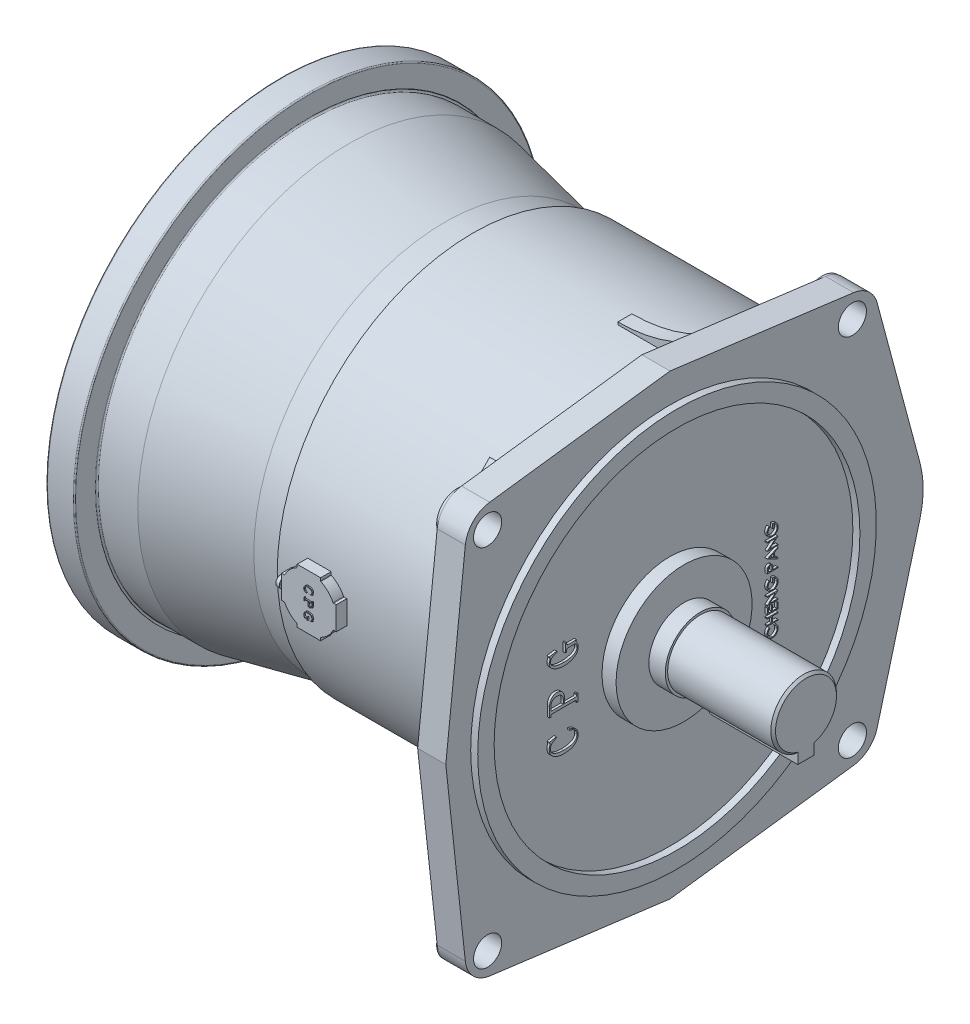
SolidWorks part; units mm, degrees
ref_plane "前视基准面" through (0, 0, 0) normal (0, 0, 1) x (1, 0, 0)
ref_plane "上视基准面" through (0, 0, 0) normal (0, 1, 0) x (1, 0, 0)
ref_plane "右视基准面" through (0, 0, 0) normal (1, 0, 0) x (0, 0, -1)
sketch "草图1" plane through (0, 0, 0) normal (0, 1, 0) x (1, 0, 0)
  line L0 (0, 0) -> (15.7361, 0) construction
  line L1 (0, 0) -> (0, -14)
  line L2 (0, -14) -> (-45, -14)
  line L3 (-45, -14) -> (-45, -15)
  line L4 (-45, -15) -> (-52, -15)
  line L5 (-55, -29) -> (-55, -85)
  line L6 (-55, -85) -> (-58, -85)
  line L7 (-58, -85) -> (-58, 0)
  line L8 (-58, 0) -> (0, 0)
  line L9 (-55, -29) -> (-52, -29)
  line L10 (-52, -29) -> (-52, -15)
  dimension "D1" = 45
  dimension "D2" = 28
  dimension "D3" = 30
  dimension "D4" = 3
  dimension "D5" = 170
  dimension "D6" = 58
  dimension "D7" = 3
  dimension "D8" = 58
revolve "旋转1" add sketch "草图1" angle 360 about L0
sketch "草图2" plane through (0, 0, 0) normal (0, 1, 0) x (1, 0, 0)
  line L0 (8.0167, 23) -> (-70, 23) construction
  line L1 (-58, 85) -> (-58, -85) construction
  line L4 (-70, 23) -> (-70, -60.5)
  line L5 (-70, -60.5) -> (-165, -60.5)
  line L6 (-165, -60.5) -> (-165, 23)
  line L11 (-70, 23) -> (-165, 23)
  dimension "D1" = 23
  dimension "D2" = 12
  dimension "D3" = 167
  dimension "D5" = 95
revolve "旋转2" add sketch "草图2" angle 360 about L0
sketch "草图12" plane through (-70, 0, 0) normal (1, 0, 0) x (0, 0, -1)
  line L0 (0, -97.5) -> (86.267, -86.267)
  line L1 (-86.267, -86.267) -> (0, -97.5)
  line L2 (-86.267, -86.267) -> (-95.6178, 0)
  line L3 (-86.267, 86.267) -> (0, 97.5)
  line L4 (86.267, -86.267) -> (109.3822, 0)
  line L5 (-95.6178, 0) -> (-86.267, 86.267)
  line L6 (0, 97.5) -> (86.267, 86.267)
  line L7 (109.3822, 0) -> (86.267, 86.267)
  line L8 (167.8979, 0) -> (-107.2143, 0) construction
  line L9 (0, 107.5085) -> (0, -103.3164) construction
  line L10 (0, 0) -> (-77.7817, 77.7817) construction
  line L11 (0, 0) -> (77.7817, 77.7817) construction
  circle A0 centre (0, 0) radius 110 construction
  circle A1 centre (-77.7817, 77.7817) radius 6
  circle A2 centre (77.7817, 77.7817) radius 6
  circle A3 centre (77.7817, -77.7817) radius 6
  circle A4 centre (-77.7817, -77.7817) radius 6
  dimension "D3" = 220
  dimension "D4" = 12
  dimension "D5" = 15
  dimension "D1" = 195
  dimension "D2" = 205
  dimension "D6" = 12
extrude "拉伸8" add sketch "草图12" along normal up to surface (12 mm away)
sketch "草图5" plane through (0, 0, 0) normal (0, 1, 0) x (1, 0, 0)
  line L0 (0, -3.5) -> (-36.5, -3.5)
  line L1 (0, -14) -> (0, 14) construction
  line L2 (-36.5, 3.5) -> (0, 3.5)
  line L3 (0, 3.5) -> (0, -3.5)
  line L4 (31.1, -13.7955) -> (31.1, 19.6443) construction
  arc A0 (-36.5, -3.5) -> (-36.5, 3.5) centre (-36.5, 0) cw
  dimension "D2" = 40
  dimension "D1" = 7
  dimension "D3" = 31.1
extrude "拉伸4" add sketch "草图5" against normal blind 17.1
fillet "圆角4" radius 12 4 edges at (-64, 86.267, 86.267) (-64, 86.267, -86.267) (-64, -86.267, -86.267) (-64, -86.267, 86.267)
fillet "圆角5" radius 40 1 edges at (-64, 0, -109.3822)
chamfer "倒角1" distance 1 angle 45 1 edges at (0, 14, 0)
sketch "草图18" plane through (-70, 0, 0) normal (-1, 0, 0) x (0, 0, 1)
  line L0 (-23, 0) -> (65.9169, -88.9169) construction
  line L1 (0, -90.75) -> (0, 90.75) construction
  line L2 (76.9039, -87.4862) -> (0, -97.5) construction
  line L3 (36.0434, -59.0434) -> (65.9169, -88.9169)
  line L4 (-23, 0) -> (-77.7817, -77.7817) construction
  line L5 (-76.7543, -75.4044) -> (-71.081, -68.2676)
  line L7 (-23, 0) -> (-23, -94.5051) construction
  line L8 (0, -97.5) -> (-78.3038, -87.3039) construction
  line L9 (-23, -85.3881) -> (-23, -94.5051)
  circle A0 centre (-23, 0) radius 83.5 construction
  arc A1 (-88.3455, -78.5102) -> (-78.3038, -87.3039) centre (-76.7543, -75.4044) ccw construction
  dimension "D1" = 45
  dimension "D2" = 9.117
  dimension "D4" = 42.2474
  dimension "D5" = 9.117
ref_plane "基准面7" through (-71, 0, 0) normal (1, 0, 0) x (0, 0, -1)
sketch "草图13" plane through (-70, 0, 0) normal (1, 0, 0) x (0, 0, -1)
  line L5 (0, 0) -> (107.7406, 0) construction
  circle A1 centre (77.7817, 77.7817) radius 9.4101
  circle A3 centre (77.7817, 77.7817) radius 6
  circle A4 centre (77.7817, -77.7817) radius 6 construction
  circle A5 centre (77.7817, -77.7817) radius 6
  circle A7 centre (-77.7817, -77.7817) radius 6
  arc A10 (78.3038, -87.3039) -> (88.3455, -78.5102) centre (76.7543, -75.4044) ccw construction
  circle A11 centre (-77.7817, -77.7817) radius 6 construction
  arc A12 (-87.2845, -76.8798) -> (-76.9039, -87.4862) centre (-75.3544, -75.5867) ccw construction
  circle A14 centre (-77.7817, 77.7817) radius 6
  circle A15 centre (-77.7817, 77.7817) radius 8.7273
  circle A20 centre (-77.7817, -77.7817) radius 8.7273
  circle A21 centre (77.7817, -77.7817) radius 9.4101
  point P8 (23, 0)
extrude "拉伸9" add sketch "草图13" against normal up to surface (1 mm away)
sketch "草图14" plane through (0, 0, 0) normal (0, 1, 0) x (1, 0, 0)
  line L0 (-70, 23) -> (-165, 23) construction
  line L5 (-70, -76.9039) -> (-70, 0) construction
  line L6 (-100.2474, -60.5) -> (-100.2474, -61.5)
  line L7 (-70, -90.7474) -> (-71, -90.7474)
  line L9 (-70, -60.5) -> (-165, -60.5) construction
  arc A0 (-71, -90.7474) -> (-100.2474, -61.5) centre (-100.2474, -90.7474) ccw
  dimension "D1" = 113.7474
  dimension "D2" = 1
  dimension "D3" = 1
rib "筋17" sketch "草图14" sketch "草图14" thickness 6 extrusion direction parallel to sketch draft on no parameters "D1"=6
pattern_circular "阵列(圆周)16" count 8 over 360 about axis through (0, 0, -23) along (1, 0, 0) of "筋17"
ref_plane "基准面8" through (0, 0, -23) normal (0, 0, 1) x (1, 0, 0)
sketch "草图17" plane through (0, 0, -23) normal (0, 0, 1) x (1, 0, 0)
  line L0 (-70, -91.617) -> (-71, -91.617)
  line L1 (-70, -87.4862) -> (-70, -97.5) construction
  line L2 (-100.2474, -83.5) -> (-100.2474, -84.5)
  line L4 (-165, -83.5) -> (-70, -83.5) construction
  line L6 (-100.2474, -61.8718) -> (-100.2474, -57.6292) construction
  arc A0 (-71, -91.617) -> (-100.2474, -84.5) centre (-100.2474, -148.1546) ccw
  dimension "D1" = 8.117
  dimension "D2" = 1
  dimension "D3" = 1
rib "筋24" sketch "草图17" sketch "草图17" thickness 6 extrusion direction parallel to sketch draft on no parameters "D1"=6
mirror "镜向1" about plane through (0, 0, 0) normal (0, 1, 0) of "筋24"
sketch "草圖1" plane through (0, 0, 0) normal (0, 1, 0) x (1, 0, 0)
  line L0 (-233.4998, 23) -> (-165, 23)
  line L1 (-246.4998, 123) -> (-235.4998, 123)
  line L2 (-234.9998, 122.5) -> (-234.9998, 114.0026)
  line L3 (-234.7902, 113) -> (-217.9998, 113)
  line L4 (-217.9998, 113) -> (-177, 104.5)
  line L5 (-205.9998, 70.375) -> (-205.9998, 71.1207)
  line L6 (-246.9998, 122.5) -> (-246.9998, 88)
  line L7 (-232.9998, 64) -> (-207.9998, 64)
  line L8 (-234.9998, 62) -> (-234.9998, 49)
  line L9 (-272.0981, 23) -> (-165, 23) construction
  line L10 (-246.9998, 88) -> (-242.6998, 88)
  line L11 (-207.3496, 76.0029) -> (-242.6998, 88)
  line L12 (-233.4998, 49) -> (-233.4998, 23)
  line L13 (-204.6838, 73.0001) -> (-204.6838, 73.0215)
  line L14 (-234.9998, 49) -> (-233.4998, 49)
  line L15 (-165, 104.5) -> (-165, 23)
  line L16 (-177, 104.5) -> (-165, 104.5)
  arc A0 (-204.6838, 73.0001) -> (-205.9998, 71.1207) centre (-203.9998, 71.1207) ccw
  arc A1 (-207.9998, 64) -> (-205.9998, 70.375) centre (-215.8093, 69.9513) ccw
  arc A2 (-232.9998, 64) -> (-234.9998, 62) centre (-232.9998, 62) ccw
  arc A6 (-204.6838, 73.0215) -> (-207.3496, 76.0029) centre (-207.6838, 73.0215) ccw
  arc A7 (-234.9998, 114.0026) -> (-234.7902, 113) centre (-234.7902, 113.5232) ccw
  arc A8 (-246.4998, 123) -> (-246.9998, 122.5) centre (-246.4998, 122.5) ccw
  arc A9 (-234.9998, 122.5) -> (-235.4998, 123) centre (-235.4998, 122.5) ccw
  dimension "D1" = 200
  dimension "D2" = 130
  dimension "D3" = 246.9998
  dimension "D4" = 165
  dimension "D6" = 81.9998
  dimension "D12" = 180
  dimension "D13" = 163
  dimension "D14" = 23
revolve "旋轉1" add sketch "草圖1" angle 360 about L9
sketch "草圖2" plane through (-246.9998, 0, 0) normal (-1, 0, 0) x (0, 0, 1)
  line L0 (-23, 0) -> (-23, 120.5316) construction
  circle A0 centre (-23, 0) radius 82.5 construction
  circle A1 centre (-81.3363, 58.3363) radius 5
  circle A2 centre (35.3363, 58.3363) radius 5
  circle A3 centre (35.3363, -58.3363) radius 5
  circle A4 centre (-81.3363, -58.3363) radius 5
  dimension "D1" = 165
  dimension "D2" = 10
extrude "伸長1" cut sketch "草圖2" against normal blind 25
sketch "草圖3" plane through (-246.9998, 0, 0) normal (-1, 0, 0) x (0, 0, 1)
  line L30 (29.4023, 23.0903) -> (47.6304, 31.1223)
  line L31 (26.5204, 27.4054) -> (35.2893, 34.6515)
  line L32 (-75.4023, -23.0903) -> (-93.6304, -31.1223)
  line L33 (-50.4054, 49.5204) -> (-57.6515, 58.2893)
  line L34 (36.1698, 46.1366) -> (30.033, 53.033)
  line L35 (29.4023, -23.0903) -> (47.6304, -31.1223)
  line L36 (4.4054, -49.5204) -> (11.6515, -58.2893)
  line L37 (26.5204, -27.4054) -> (35.2893, -34.6515)
  line L38 (-69.1366, 59.1698) -> (-76.033, 53.033)
  line L39 (-72.5204, 27.4054) -> (-81.2893, 34.6515)
  line L40 (23.1366, -59.1698) -> (30.033, -53.033)
  line L41 (0.0903, -52.4023) -> (8.1223, -70.6304)
  line L42 (36.1698, -46.1366) -> (30.033, -53.033)
  line L43 (-46.0903, -52.4023) -> (-54.1223, -70.6304)
  line L44 (0.0903, 52.4023) -> (8.1223, 70.6304)
  line L45 (-82.1698, -46.1366) -> (-76.033, -53.033)
  line L46 (-72.5204, -27.4054) -> (-81.2893, -34.6515)
  line L47 (-50.4054, -49.5204) -> (-57.6515, -58.2893)
  line L48 (-69.1366, -59.1698) -> (-76.033, -53.033)
  line L49 (-23, 0) -> (-23, 84.5) construction
  line L50 (-23, 0) -> (-23, -84.5) construction
  line L51 (-46.0903, 52.4023) -> (-54.1223, 70.6304)
  line L52 (23.1366, 59.1698) -> (30.033, 53.033)
  line L53 (-75.4023, 23.0903) -> (-93.6304, 31.1223)
  line L54 (4.4054, 49.5204) -> (11.6515, 58.2893)
  line L55 (-82.1698, 46.1366) -> (-76.033, 53.033)
  line L56 (-23, 0) -> (-107.5, 0) construction
  line L57 (-23, 0) -> (61.5, 0) construction
  arc A48 (-82.1698, 46.1366) -> (-81.2893, 34.6515) centre (-76.1934, 40.8184) ccw
  arc A50 (57.0874, 26.949) -> (61.5, 0) centre (-23, 0) cw
  arc A51 (57.0874, -26.949) -> (61.5, 0) centre (-23, 0) ccw
  arc A52 (0.0903, -52.4023) -> (0.9103, -49.5308) centre (1.7798, -51.3319) cw
  arc A53 (3.949, -80.0874) -> (8.1223, -70.6304) centre (1.7166, -73.453) ccw
  arc A54 (-46.0903, -52.4023) -> (-46.9103, -49.5308) centre (-47.7798, -51.3319) ccw
  arc A55 (-103.0874, -26.949) -> (-107.5, 0) centre (-23, 0) cw
  arc A56 (0.0903, 52.4023) -> (0.9103, 49.5308) centre (1.7798, 51.3319) ccw
  arc A57 (26.0121, 24.9562) -> (26.5308, 23.9103) centre (-23, 0) cw
  arc A58 (26.0121, -24.9562) -> (26.5308, -23.9103) centre (-23, 0) ccw
  arc A59 (-103.0874, -26.949) -> (-93.6304, -31.1223) centre (-96.453, -24.7166) ccw
  arc A60 (23.1366, 59.1698) -> (11.6515, 58.2893) centre (17.8184, 53.1934) ccw
  arc A61 (26.0121, 24.9562) -> (26.5204, 27.4054) centre (27.7944, 25.8637) cw
  arc A62 (1.9562, -49.0121) -> (0.9103, -49.5308) centre (-23, 0) cw
  arc A63 (-75.4023, -23.0903) -> (-72.5308, -23.9103) centre (-74.3319, -24.7798) cw
  arc A64 (-103.0874, 26.949) -> (-107.5, 0) centre (-23, 0) ccw
  arc A65 (-103.0874, 26.949) -> (-93.6304, 31.1223) centre (-96.453, 24.7166) cw
  arc A66 (-82.1698, -46.1366) -> (-81.2893, -34.6515) centre (-76.1934, -40.8184) cw
  arc A67 (3.949, 80.0874) -> (-23, 84.5) centre (-23, 0) ccw
  arc A68 (1.9562, 49.0121) -> (4.4054, 49.5204) centre (2.8637, 50.7944) ccw
  arc A69 (36.1698, -46.1366) -> (35.2893, -34.6515) centre (30.1934, -40.8184) ccw
  arc A70 (23.1366, -59.1698) -> (11.6515, -58.2893) centre (17.8184, -53.1934) cw
  arc A71 (-47.9562, 49.0121) -> (-50.4054, 49.5204) centre (-48.8637, 50.7944) cw
  arc A72 (-46.0903, 52.4023) -> (-46.9103, 49.5308) centre (-47.7798, 51.3319) cw
  arc A73 (29.4023, -23.0903) -> (26.5308, -23.9103) centre (28.3319, -24.7798) ccw
  arc A74 (1.9562, -49.0121) -> (4.4054, -49.5204) centre (2.8637, -50.7944) cw
  arc A75 (-72.0121, -24.9562) -> (-72.5204, -27.4054) centre (-73.7944, -25.8637) cw
  arc A76 (-47.9562, 49.0121) -> (-46.9103, 49.5308) centre (-23, 0) cw
  arc A77 (57.0874, -26.949) -> (47.6304, -31.1223) centre (50.453, -24.7166) cw
  circle A78 centre (-23, 0) radius 50
  arc A79 (-69.1366, -59.1698) -> (-57.6515, -58.2893) centre (-63.8184, -53.1934) ccw
  arc A80 (-75.4023, 23.0903) -> (-72.5308, 23.9103) centre (-74.3319, 24.7798) ccw
  arc A81 (-49.949, -80.0874) -> (-23, -84.5) centre (-23, 0) ccw
  arc A82 (-72.0121, -24.9562) -> (-72.5308, -23.9103) centre (-23, 0) cw
  arc A83 (-72.0121, 24.9562) -> (-72.5308, 23.9103) centre (-23, 0) ccw
  arc A84 (57.0874, 26.949) -> (47.6304, 31.1223) centre (50.453, 24.7166) ccw
  arc A85 (-47.9562, -49.0121) -> (-46.9103, -49.5308) centre (-23, 0) ccw
  arc A86 (-49.949, 80.0874) -> (-54.1223, 70.6304) centre (-47.7166, 73.453) ccw
  arc A87 (-72.0121, 24.9562) -> (-72.5204, 27.4054) centre (-73.7944, 25.8637) ccw
  arc A88 (3.949, -80.0874) -> (-23, -84.5) centre (-23, 0) cw
  arc A89 (-49.949, -80.0874) -> (-54.1223, -70.6304) centre (-47.7166, -73.453) cw
  arc A90 (-47.9562, -49.0121) -> (-50.4054, -49.5204) centre (-48.8637, -50.7944) ccw
  arc A91 (-49.949, 80.0874) -> (-23, 84.5) centre (-23, 0) cw
  arc A92 (-69.1366, 59.1698) -> (-57.6515, 58.2893) centre (-63.8184, 53.1934) cw
  arc A93 (3.949, 80.0874) -> (8.1223, 70.6304) centre (1.7166, 73.453) cw
  arc A94 (29.4023, 23.0903) -> (26.5308, 23.9103) centre (28.3319, 24.7798) cw
  arc A95 (1.9562, 49.0121) -> (0.9103, 49.5308) centre (-23, 0) ccw
  arc A96 (36.1698, 46.1366) -> (35.2893, 34.6515) centre (30.1934, 40.8184) cw
  arc A97 (26.0121, -24.9562) -> (26.5204, -27.4054) centre (27.7944, -25.8637) ccw
  point P144 (-62.9374, 64.6861)
  point P173 (41.6861, 39.9374)
  point P201 (16.9374, -64.6861)
  point P228 (-87.6861, -39.9374)
  dimension "D5" = 110
  dimension "D6" = 100
extrude "伸長2" cut sketch "草圖3" against normal blind 50
sketch "草圖4" plane through (-196.9998, 0, 0) normal (-1, 0, 0) x (0, 0, 1)
  circle A0 centre (-23, 0) radius 66.5 construction
  circle A1 centre (-70.0226, 47.0226) radius 3.5
  circle A2 centre (24.0226, 47.0226) radius 3.5
  circle A3 centre (24.0226, -47.0226) radius 3.5
  circle A4 centre (-70.0226, -47.0226) radius 3.5
  dimension "D1" = 133
  dimension "D2" = 7
extrude "伸長3" cut sketch "草圖4" against normal blind 11
sketch "草圖6" plane through (-233.4998, 0, 0) normal (-1, 0, 0) x (0, 0, 1)
  line L0 (-46.2551, 0) -> (0.2551, 0) construction
  line L1 (-23, 23.2551) -> (-23, -23.2551) construction
  line L2 (-10.7, 3) -> (-10.7, -3)
  line L3 (-13.4606, 3) -> (-14.1683, 3.5)
  line L4 (-10.7, 3) -> (-13.4606, 3)
  line L5 (-13.4606, -3) -> (-14.1683, -3.5)
  line L6 (-10.7, -3) -> (-13.4606, -3)
  arc A0 (-14.1683, 3.5) -> (-14.1683, -3.5) centre (-23, 0) ccw
  circle A1 centre (-23, 0) radius 19.9 construction
  dimension "D1" = 9.5
extrude "伸長4" cut sketch "草圖6" against normal blind 40
sketch "草圖7" plane through (-233.4998, 0, 0) normal (-1, 0, 0) x (0, 0, 1)
  circle A0 centre (-23, 0) radius 19.9 construction
  circle A1 centre (-23, 0) radius 19.9
  arc A2 (-14.1683, 3.5) -> (-14.1683, -3.5) centre (-23, 0) ccw construction
  arc A3 (-14.1683, 3.5) -> (-14.1683, -3.5) centre (-23, 0) ccw
extrude "伸長5" add sketch "草圖7" along normal blind 1 contours A1 M6 M1 M2 M3 M4 M5
sketch "草圖8" plane through (-55, 0, 0) normal (1, 0, 0) x (0, 0, -1)
  circle A0 centre (0, 0) radius 78
  circle A1 centre (0, 0) radius 29 construction
  circle A2 centre (0, 0) radius 29
  dimension "D1" = 156
extrude "伸長6" cut sketch "草圖8" against normal blind 3
sketch "草圖9"
  dimension "D1" = 40
  dimension "D2" = 45
  dimension "D3" = 70
  dimension "D4" = 70
  dimension "D5" = 35
extrude "伸長7" add sketch "草圖9" along normal blind 1
ref_plane "平面1" through (0, 0, 65) normal (0, 0, 1) x (1, 0, 0)
sketch "草圖10" plane through (0, 0, 65) normal (0, 0, 1) x (1, 0, 0)
  line L0 (-152, 11.65) -> (-142, 11.65)
  line L1 (-152, 11.65) -> (-152, 10.5119)
  line L2 (-142, 11.65) -> (-142, 10.5119)
  line L3 (-152, -10.5119) -> (-152, -11.65)
  line L4 (-142, -10.5119) -> (-142, -11.65)
  line L5 (-158.65, 5) -> (-157.5119, 5)
  line L6 (-158.65, -5) -> (-157.5119, -5)
  line L7 (-158.65, -5) -> (-158.65, 5)
  line L8 (-152, -11.65) -> (-152, -10.5119)
  line L9 (-142, -11.65) -> (-142, -10.5119)
  line L10 (-142, -11.65) -> (-152, -11.65)
  line L11 (-135.35, -5) -> (-136.4881, -5)
  line L12 (-135.35, 5) -> (-136.4881, 5)
  line L13 (-135.35, 5) -> (-135.35, -5)
  arc A0 (-152.1383, 10.2882) -> (-157.2882, 5.1383) centre (-147, 0) ccw
  arc A1 (-152.1383, 10.2882) -> (-152, 10.5119) centre (-152.25, 10.5119) ccw
  arc A2 (-142, 10.5119) -> (-141.8617, 10.2882) centre (-141.75, 10.5119) ccw
  arc A3 (-157.5119, 5) -> (-157.2882, 5.1383) centre (-157.5119, 5.25) ccw
  arc A4 (-157.2882, -5.1383) -> (-157.5119, -5) centre (-157.5119, -5.25) ccw
  arc A5 (-152, -10.5119) -> (-152.1383, -10.2882) centre (-152.25, -10.5119) ccw
  arc A6 (-141.8617, -10.2882) -> (-142, -10.5119) centre (-141.75, -10.5119) ccw
  arc A7 (-136.4881, -5) -> (-136.7118, -5.1383) centre (-136.4881, -5.25) ccw
  arc A8 (-136.7118, 5.1383) -> (-136.4881, 5) centre (-136.4881, 5.25) ccw
  arc A9 (-136.7118, 5.1383) -> (-141.8617, 10.2882) centre (-147, 0) ccw
  arc A10 (-157.2882, -5.1383) -> (-152.1383, -10.2882) centre (-147, 0) ccw
  arc A11 (-141.8617, -10.2882) -> (-136.7118, -5.1383) centre (-147, 0) ccw
extrude "伸長8" add sketch "草圖10" against normal blind 4.5 contours A6 A11 A7 L11 L13 L12 A8 A9 A2 L2 L0 L1 A1 A0 A3 L5 L7 L6 A4 A10 A5 L3 L10 L4
sketch "草圖11"
extrude "伸長9" add sketch "草圖11" along normal blind 0.5
sketch "草圖12" plane through (0, 0, 0) normal (0, 1, 0) x (1, 0, 0)
  line L0 (-161.15, -62.75) -> (-153.15, -62.75)
  line L1 (-161.15, -62.75) -> (-161.15, -60.55)
  line L2 (-159.65, -61.3) -> (-159.65, -60.55)
  line L3 (-110, -65) -> (110, -65) construction
  line L13 (-157.65, -61.3) -> (-153.15, -61.55)
  line L15 (-159.65, -61.3) -> (-157.65, -61.3)
  line L23 (-161.15, -60.55) -> (-159.65, -60.55)
  line L24 (-157.65, -62.75) -> (-157.65, -61.3)
  line L25 (-153.15, -62.75) -> (-153.15, -61.55)
  dimension "D1" = 2.25
revolve "旋轉2" add sketch "草圖12" angle 360 about L0
equation "\"D6@草圖1\" = \"D3@草圖1\"-\"D4@草圖1\""
equation "\"D3@草图1\" = \"D2@草图1\"+2"
equation "\"D1@拉伸4\" = \"D3@草图5\"-\"D2@草图1\"/2"
equation "\"D5@草图1\" = \"D1@草圖8\"+14"
